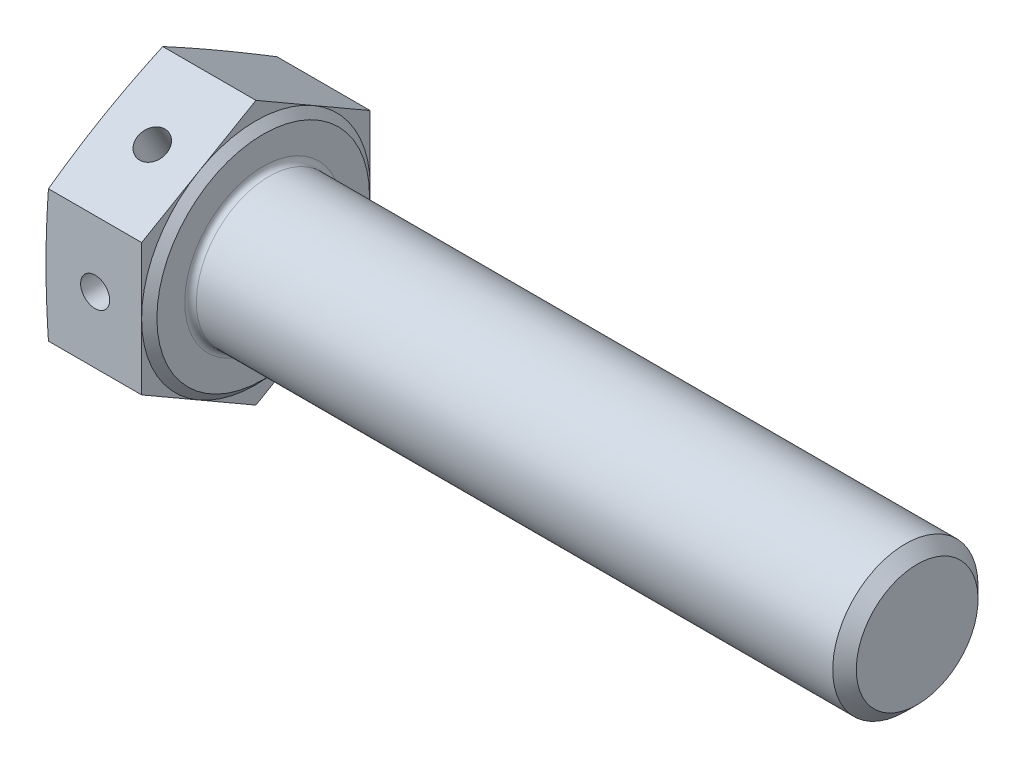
SolidWorks part; units mm, degrees
ref_plane "Front" through (0, 0, 0) normal (0, 0, 1) x (1, 0, 0)
ref_plane "Top" through (0, 0, 0) normal (0, 1, 0) x (1, 0, 0)
ref_plane "Right" through (0, 0, 0) normal (1, 0, 0) x (0, 0, -1)
sketch "Sketch-BaseHead" plane through (0, 0, 0) normal (1, 0, 0) x (0, 0, -1)
  line L1 (0, -9.0817) -> (7.865, -4.5409)
  line L2 (7.865, -4.5409) -> (7.865, 4.5409)
  line L3 (7.865, 4.5409) -> (0, 9.0817)
  line L4 (0, 9.0817) -> (-7.865, 4.5409)
  line L5 (-7.865, 4.5409) -> (-7.865, -4.5409)
  line L6 (-7.865, -4.5409) -> (0, -9.0817)
  circle A0 centre (0, 0) radius 7.865 construction
  dimension "s" = 15.73
extrude "BaseHead" add sketch "Sketch-BaseHead" along normal blind 6.58
sketch "Sketch4" plane through (-0.2646, -5.9169, 0) normal (0, 0, 1) x (0, 1, 0)
  line L0 (5.9169, 3.7369) -> (5.9169, -10.4477) construction
  line L2 (14.9986, -0.2646) -> (13.7819, -0.2646)
  line L4 (13.7819, -0.2646) -> (14.9986, -0.4327)
  line L6 (14.9986, -0.4327) -> (14.9986, -0.2646)
  dimension "D1" = 7.865
  dimension "D2" = 15.73
revolve "HeadChamfer" cut sketch "Sketch4" angle 360 about L0
sketch "Sketch2" plane through (0, 0, 0) normal (0, 1, 0) x (1, 0, 0)
  line L0 (6.58, 0) -> (7.08, 0)
  line L1 (7.08, 0) -> (7.08, 7.315)
  line L2 (7.08, 7.315) -> (6.58, 7.865)
  line L3 (6.58, 7.865) -> (6.58, 0)
  line L4 (6.58, 7.865) -> (6.58, 0) construction
  dimension "D1" = 7.865
  dimension "D2" = 7.315
  dimension "c" = 0.5
revolve "Revolve1" add sketch "Sketch2" angle 360 about axis through (-4.0016, 0, 0) along (1, 0, 0)
ref_plane "Plane2" through (26.08, 0, 0) normal (1, 0, 0) x (0, 0, -1)
sketch "Sketch3" plane through (7.08, 0, 0) normal (1, 0, 0) x (0, 0, -1)
  circle A0 centre (0, 0) radius 5
  dimension "d" = 10
extrude "BaseBody" add sketch "Sketch3" along normal blind 45
chamfer "Chamfer1" distance 0.812 angle 45 1 edges at (52.08, 5, 0)
fillet "HeadFillet" radius 0.4 1 edges at (7.08, -5, 0)
sketch "Sketch5" plane through (0, 0, 0) normal (0, 0, 1) x (1, 0, 0)
  line L1 (6.58, -6.8113) -> (6.58, -9.0817) construction
  line L2 (-4.0016, 0) -> (10.1831, 0) construction
  circle A0 centre (3.38, 0) radius 1
  dimension "d1" = 2
  dimension "h" = 3.2
extrude "Hole" cut sketch "Sketch5" against normal through all and the other way through all
pattern_circular "CirPattern1" count 2 over 60 about axis through (52.08, 0, 0) along (-1, 0, 0) of "Hole"
equation "\"D1@Sketch4\" = \"s@Sketch-BaseHead\"/ 2 "
equation "\"D2@Sketch4\" = \"s@Sketch-BaseHead\""
equation "\"D1@Chamfer1\" =  ( \"d@Sketch3\" - \"D2@ThreadCosmetic1\" ) / 2 "
equation "\"b@ThreadCosmetic1\" = \"l@BaseBody\" - \"lg@Plane2\""
equation "\"D1@Sketch2\"=\"s@Sketch-BaseHead\"/2"
